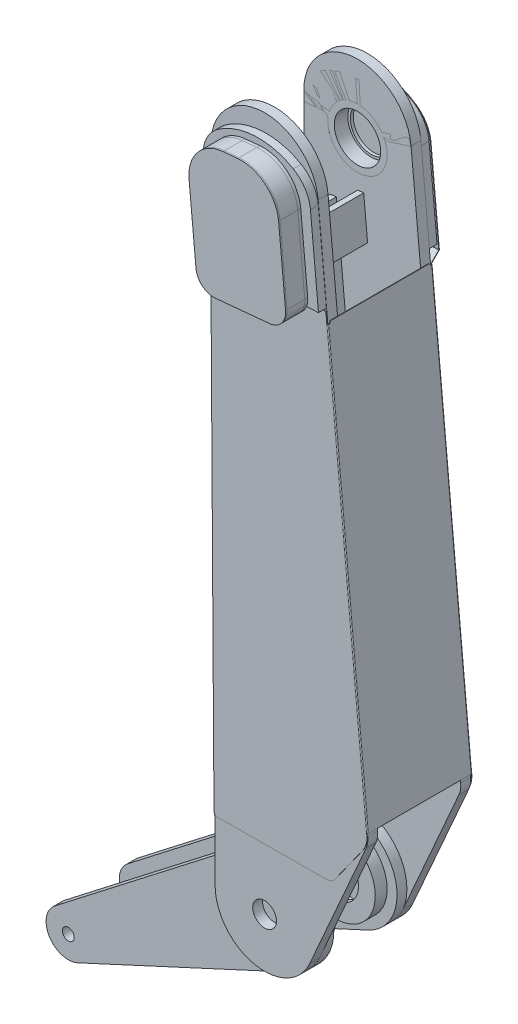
SolidWorks part; units mm, degrees
ref_plane "Ebene vorne" through (0, 0, 0) normal (0, 0, 1) x (1, 0, 0)
ref_plane "Ebene oben" through (0, 0, 0) normal (0, 1, 0) x (1, 0, 0)
ref_plane "Ebene rechts" through (0, 0, 0) normal (1, 0, 0) x (0, 0, -1)
imported_body "P001066-2-solid1"
imported_body "P001067-5-solid1"
imported_body "P001063-1-solid1"
imported_body "P001062-2-solid1"
imported_body "P001061-2-solid1"
imported_body "P001060-4-solid1"
imported_body "P001052-1-solid1"
imported_body "P001068-1/P000026-2-solid1"
imported_body "P001068-1/P000028-1-solid1"
imported_body "P001068-1/P000029-1-solid1"
imported_body "P001053-1-solid1"
imported_body "P001059-1-solid1"
imported_body "P001058-2-solid1"
imported_body "P001053-3-solid1"
imported_body "P001448-1-solid1"
imported_body "P001539-1-solid1"
other "Fläche löschen1"
